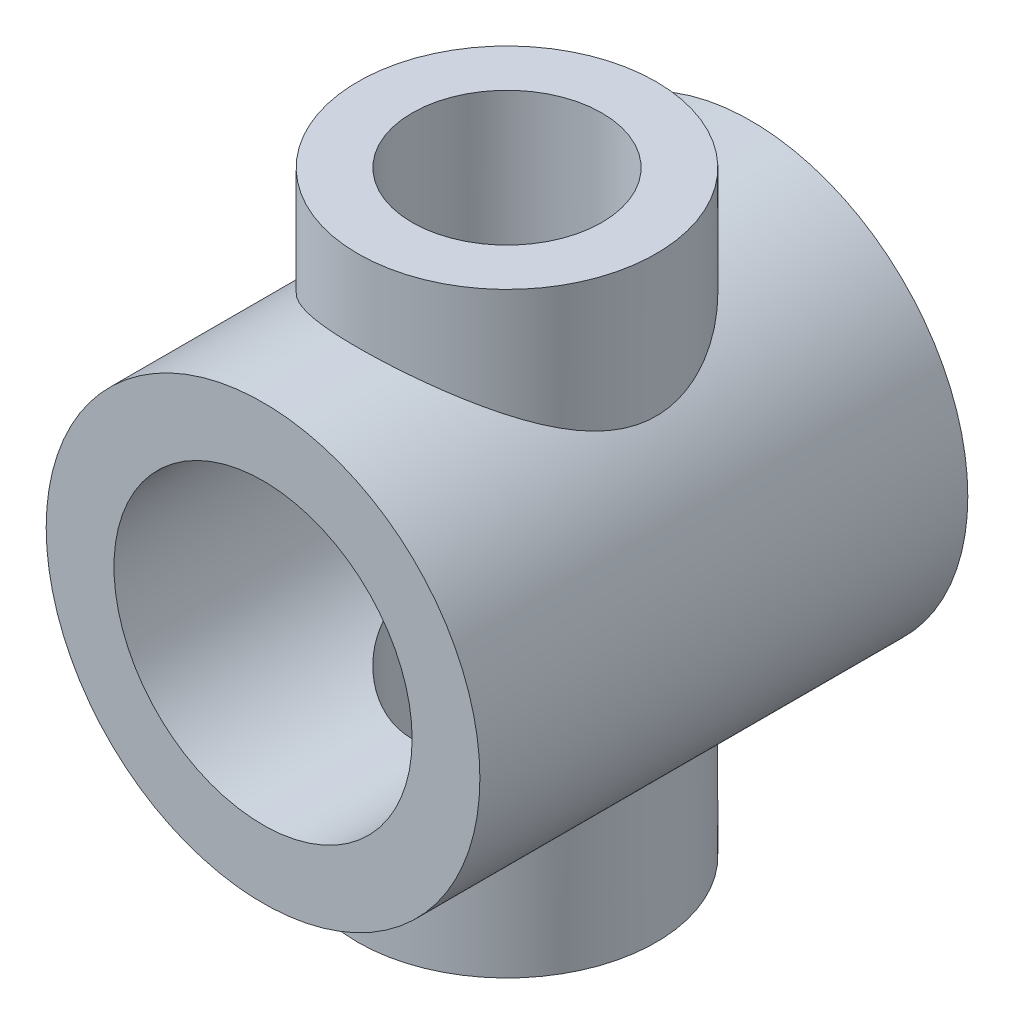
SolidWorks part; units mm, degrees
ref_plane "前视基准面" through (0, 0, 0) normal (0, 0, 1) x (1, 0, 0)
ref_plane "上视基准面" through (0, 0, 0) normal (0, 1, 0) x (1, 0, 0)
ref_plane "右视基准面" through (0, 0, 0) normal (1, 0, 0) x (0, 0, -1)
sketch "草图1" plane through (0, 0, 0) normal (0, 0, 1) x (0, -1, 0)
  circle A0 centre (0, 0) radius 8
  dimension "D1" = 16
extrude "凸台-拉伸1" add sketch "草图1" along normal blind 18
sketch "草图3" plane through (0, 0, 0) normal (0, 1, 0) x (1, 0, 0)
  line L0 (0, -2.914) -> (0, -15.086) construction
  line L1 (-6.0116, -9) -> (5.0593, -9) construction
  circle A0 centre (0, -9) radius 5.5
  dimension "D1" = 11
extrude "凸台-拉伸3" add sketch "草图3" along normal mid plane 22
sketch "草图4" plane through (0, 0, 0) normal (0, 1, 0) x (1, 0, 0)
  circle A0 centre (0, -9) radius 3.5
  dimension "D1" = 7
extrude "切除-拉伸4" cut sketch "草图4" along normal mid plane 32
sketch "草图7" plane through (0, 0, 0) normal (0, 0, 1) x (1, 0, 0)
  circle A0 centre (0, 0) radius 5.5
  dimension "D1" = 11
extrude "切除-拉伸5" cut sketch "草图7" along normal blind 21
